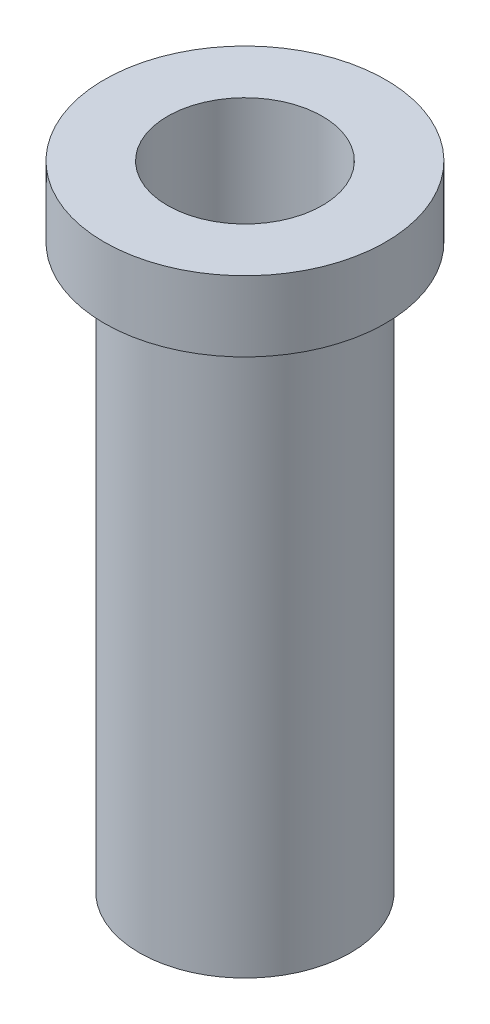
SolidWorks part; units mm, degrees
ref_plane "Front Plane" through (0, 0, 0) normal (0, 0, 1) x (1, 0, 0)
ref_plane "Top Plane" through (0, 0, 0) normal (0, 1, 0) x (1, 0, 0)
ref_plane "Right Plane" through (0, 0, 0) normal (1, 0, 0) x (0, 0, -1)
sketch "Sketch1" plane through (0, 0, 0) normal (0, 1, 0) x (1, 0, 0)
  circle A0 centre (0, 0) radius 10
  circle A1 centre (0, 0) radius 5.5
  dimension "D1" = 20
  dimension "D2" = 11
extrude "Boss-Extrude1" add sketch "Sketch1" along normal blind 5
sketch "Sketch2" plane through (0, 0, 0) normal (0, -1, 0) x (1, 0, 0)
  circle A0 centre (0, 0) radius 7.5
  dimension "D1" = 15
extrude "Boss-Extrude2" add sketch "Sketch2" along normal blind 40
sketch "Sketch3" plane through (0, 0, 0) normal (0, 1, 0) x (1, 0, 0)
  circle A0 centre (0, 0) radius 5.5 construction
  circle A1 centre (0, 0) radius 5.5
extrude "Cut-Extrude1" cut sketch "Sketch3" against normal through all
